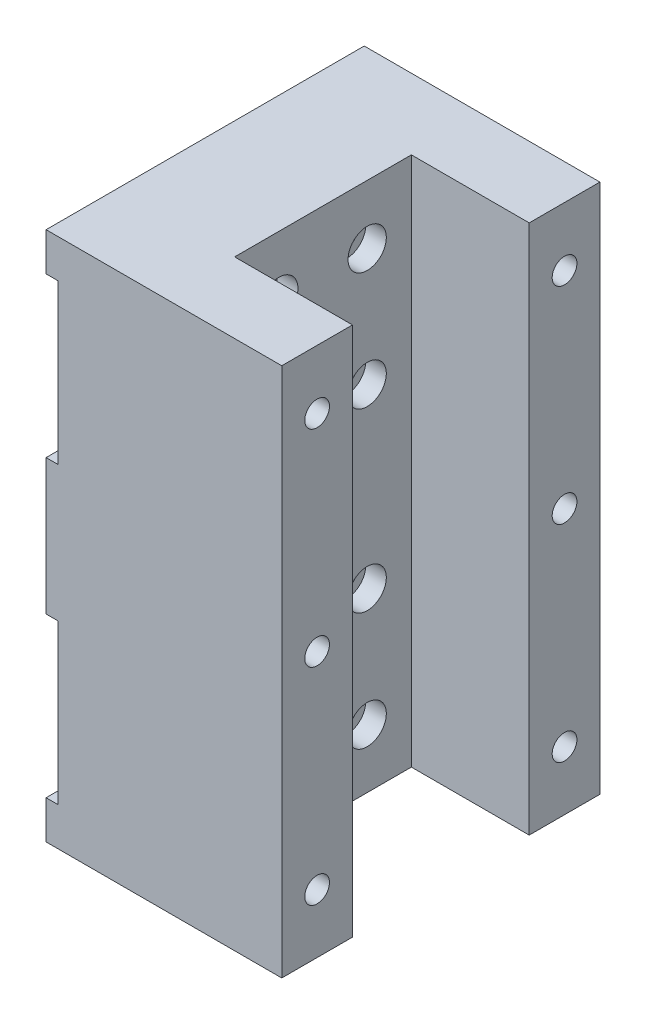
SolidWorks part; units mm, degrees
ref_plane "前视基准面" through (0, 0, 0) normal (0, 0, 1) x (1, 0, 0)
ref_plane "上视基准面" through (0, 0, 0) normal (0, 1, 0) x (1, 0, 0)
ref_plane "右视基准面" through (0, 0, 0) normal (1, 0, 0) x (0, 0, -1)
sketch "草图1" plane through (0, 0, 0) normal (0, 0, 1) x (1, 0, 0)
  line L0 (0, 90) -> (40, 90)
  line L1 (0, 0) -> (40, 0)
  line L2 (0, 0) -> (0, 6.5)
  line L3 (40, 0) -> (40, 90)
  line L4 (0, 83.5) -> (2, 83.5)
  line L5 (0, 56.5) -> (2, 56.5)
  line L6 (2, 33.5) -> (0, 33.5)
  line L7 (2, 6.5) -> (0, 6.5)
  line L8 (2, 6.5) -> (2, 33.5)
  line L9 (2, 56.5) -> (2, 83.5)
  line L10 (0, 83.5) -> (0, 90)
  line L11 (0, 33.5) -> (0, 56.5)
extrude "凸台-拉伸1" add sketch "草图1" along normal blind 54
sketch "草图2" plane through (0, 90, 0) normal (0, 1, 0) x (1, 0, 0)
  line L0 (20, -12) -> (46.2369, -12)
  line L1 (46.2369, -12) -> (46.2369, -42)
  line L2 (46.2369, -42) -> (20, -42)
  line L3 (20, -42) -> (20, -12)
extrude "切除-拉伸1" cut sketch "草图2" against normal through all
sketch "草图3" plane through (0, 0, 0) normal (0, -1, 0) x (1, 0, 0)
  circle A0 centre (25, 48) radius 2.5
  circle A1 centre (25, 6) radius 2.5
  circle A2 centre (10, 48) radius 2.5
  circle A3 centre (10, 6) radius 2.5
extrude "切除-拉伸2" cut sketch "草图3" against normal blind 25
sketch "草图4" plane through (40, 0, 0) normal (1, 0, 0) x (0, 0, -1)
  circle A0 centre (-48, 80) radius 2.1
  circle A1 centre (-6, 80) radius 2.1
  circle A2 centre (-48, 45) radius 2.1
  circle A3 centre (-6, 45) radius 2.1
  circle A4 centre (-6, 10) radius 2.1
  circle A5 centre (-48, 10) radius 2.1
extrude "切除-拉伸3" cut sketch "草图4" against normal blind 25
sketch "草图5" plane through (20, 0, 0) normal (1, 0, 0) x (0, 0, -1)
  circle A0 centre (-34.5, 30) radius 1.75
  circle A1 centre (-19.5, 30) radius 1.75
  circle A2 centre (-34.5, 10) radius 1.75
  circle A3 centre (-19.5, 10) radius 1.75
  circle A4 centre (-34.5, 60) radius 1.75
  circle A5 centre (-19.5, 60) radius 1.75
  circle A6 centre (-19.5, 80) radius 1.75
  circle A7 centre (-34.5, 80) radius 1.75
extrude "切除-拉伸4" cut sketch "草图5" against normal blind 25
sketch "草图6" plane through (20, 0, 0) normal (1, 0, 0) x (0, 0, -1)
  circle A0 centre (-34.5, 30) radius 3.25
  circle A1 centre (-19.5, 30) radius 3.25
  circle A2 centre (-34.5, 10) radius 3.25
  circle A3 centre (-19.5, 10) radius 3.25
  circle A4 centre (-34.5, 60) radius 3.25
  circle A5 centre (-19.5, 60) radius 3.25
  circle A6 centre (-19.5, 80) radius 3.25
  circle A7 centre (-34.5, 80) radius 3.25
extrude "切除-拉伸5" cut sketch "草图6" against normal blind 3.5
